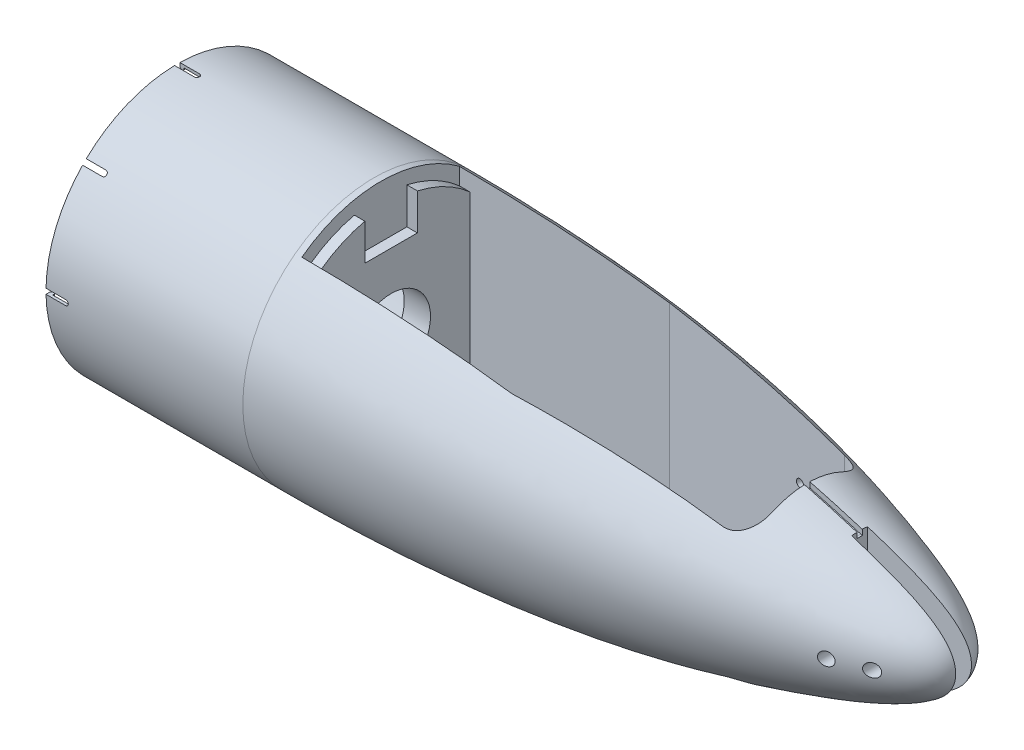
SolidWorks part; units mm, degrees
ref_plane "Plan de face" through (0, 0, 0) normal (0, 0, 1) x (1, 0, 0)
ref_plane "Plan de dessus" through (0, 0, 0) normal (0, 1, 0) x (1, 0, 0)
ref_plane "Plan de droite" through (0, 0, 0) normal (1, 0, 0) x (0, 0, -1)
sketch "Esquisse1" plane through (0, 0, 0) normal (0, 0, 1) x (1, 0, 0)
  line L0 (-8.8433, 0) -> (730.3993, 0) construction
  line L1 (0, 100) -> (150, 100)
  line L2 (600, 218.0578) -> (600, -141.2619) construction
  line L3 (600, -45.7609) -> (600, 53.6794) construction
  line L4 (137, 53.6357) -> (138, 53.6357)
  line L5 (143, 48.6357) -> (143, 0)
  line L7 (600, 0) -> (143, 0)
  line L8 (3, 96) -> (0, 96)
  line L9 (0, 100) -> (0, 96)
  line L10 (3, 97.9954) -> (3, 96)
  arc A0 (143, 48.6357) -> (138, 53.6357) centre (138, 48.6357) ccw
  spline S0 degree 3 poles (150, 100) (330.744, 100) (523.987, 58.056) (600, 22.2177) (600, 0) knots 0 0 0 0 0.598241 1 1 1 1
  spline S1 degree 3 poles (1208.675, -1647.8713) (160.0356, 15.2751) (156.5031, 22.0178) (142.0364, 46.0991) (141.7308, 46.6091) (141.3556, 47.2297) (140.8715, 48.0125) (139.9991, 49.3851) (138.7162, 51.2924) (136.5744, 54.2557) (133.7423, 57.7829) (128.905, 63.0587) (122.3364, 68.9747) (110.9199, 77.0765) (95.3093, 84.85) (75.377, 91.1248) (58.4349, 94.3621) (45.0715, 96.0519) (35.2422, 96.9383) (25.7058, 97.5116) (18.0872, 97.7834) (12.2417, 97.9099) (7.9944, 97.9674) (-48.1395, 98.353) (-62.4351, 92.9816) (2001.9041, 161.8289) knots -0.515918 -0.515918 -0.515918 -0.515918 0.007937 0.011905 0.015874 0.019842 0.02381 0.031747 0.047621 0.063495 0.095242 0.126989 0.190484 0.253978 0.380968 0.507957 0.634946 0.69844 0.761935 0.82543 0.888924 0.920671 0.952419 0.984166 2.22719 2.22719 2.22719 2.22719 only from (143, 44.4943) to (3, 97.9954) construction
  spline S2 degree 3 poles (137, 53.6357) (135.9392, 55.0467) (133.7056, 57.8229) (128.905, 63.0587) (122.3364, 68.9747) (110.9199, 77.0765) (95.3093, 84.85) (75.377, 91.1248) (58.4349, 94.3621) (45.0715, 96.0519) (35.2422, 96.9383) (25.7058, 97.5116) (18.0872, 97.7834) (12.2417, 97.9099) (7.9944, 97.9674) (4.9499, 97.9883) (3.3075, 97.9945) (3, 97.9954) knots 0.064458 0.064458 0.064458 0.064458 0.095242 0.126989 0.190484 0.253978 0.380968 0.507957 0.634946 0.69844 0.761935 0.82543 0.888924 0.920671 0.952419 0.984166 0.991532 0.991532 0.991532 0.991532
  point P18 (143, 53.6357)
  dimension "D6" = 5
  dimension "D1" = 450
  dimension "D2" = 6
  dimension "D3" = 600
  dimension "D4" = 80
  dimension "D5" = 52
  dimension "D7" = 457
  dimension "D8" = 4
revolve "Révolution1" add sketch "Esquisse1" angle 360 about L0
sketch "Esquisse2" plane through (0, 0, 0) normal (0, 0, 1) x (1, 0, 0)
  line L0 (600, 218.0578) -> (600, -141.2619) construction
  line L1 (520, 92.9537) -> (621.7344, 92.9537)
  line L2 (520, 92.9537) -> (520, -83.2647)
  line L3 (520, -83.2647) -> (621.7344, -83.2647)
  line L4 (621.7344, 92.9537) -> (621.7344, -83.2647)
  dimension "D1" = 80
extrude "Enlèv. mat.-Extru.1" cut sketch "Esquisse2" against normal mid plane 12
sketch "Esquisse3" plane through (0, 0, 0) normal (0, 1, 0) x (1, 0, 0)
  line L0 (-42.7948, 0) -> (651.3997, 0) construction
  line L1 (155, -60) -> (315, -60)
  line L2 (155, 60) -> (155, -60)
  line L3 (315, -60) -> (461.8107, -46.6536)
  line L4 (480, 26.7357) -> (480, -26.7357)
  line L5 (155, 60) -> (315, 60)
  line L6 (315, 60) -> (461.8107, 46.6536)
  arc A0 (461.8107, -46.6536) -> (480, -26.7357) centre (460, -26.7357) ccw
  arc A1 (461.8107, 46.6536) -> (480, 26.7357) centre (460, 26.7357) cw
  point P11 (480, -45)
  point P14 (480, 45)
  dimension "D9" = 20
  dimension "D1" = 120
  dimension "D2" = 60
  dimension "D3" = 90
  dimension "D4" = 45
  dimension "D5" = 325
  dimension "D6" = 155
  dimension "D7" = 160
  dimension "D8" = 160
extrude "Enlèv. mat.-Extru.2" cut sketch "Esquisse3" against normal mid plane 300
sketch "Esquisse4" plane through (143, 0, 0) normal (-1, 0, 0) x (0, 0, 1)
  circle A0 centre (0, 0) radius 30
  dimension "D1" = 60
extrude "Enlèv. mat.-Extru.3" cut sketch "Esquisse4" against normal blind 20
sketch "Esquisse7" plane through (0, 0, 0) normal (0, 1, 0) x (1, 0, 0)
  line L0 (540, 60.949) -> (540, -65.4895) construction
  line L1 (520, -6) -> (520, 6) construction
  line L2 (-21.3041, 0) -> (618.2976, 0) construction
  line L4 (540, -27.5821) -> (540, 25.0504)
  line L6 (537, -15) -> (537, 15)
  line L7 (540, 50.5643) -> (535, 50.5643)
  line L8 (540, 50.5643) -> (540, 25.0504)
  line L9 (537, 15) -> (535, 15)
  line L10 (535, 50.5643) -> (535, 15)
  line L11 (540, -50.2076) -> (535, -50.2076)
  line L12 (540, -50.2076) -> (540, -27.5821)
  line L13 (537, -15) -> (535, -15)
  line L14 (535, -50.2076) -> (535, -15)
  dimension "D1" = 20
  dimension "D2" = 3
  dimension "D3" = 5
  dimension "D4" = 15
  dimension "D5" = 30
revolve "Enlèvement de matière-Révolution1" cut sketch "Esquisse7" angle 360 about L0
pattern_linear "Répétition linéaire1" count 2 spacing 25 along (1, 0, 0) of "Enlèvement de matière-Révolution1"
sketch "Esquisse9" plane through (155, 0, 0) normal (1, 0, 0) x (0, 0, -1)
  line L0 (-60, -79.992) -> (-60, 79.992) construction
  line L1 (-60, -67.0734) -> (-60, 67.0734)
  line L2 (60, -79.992) -> (60, 79.992) construction
  line L3 (60, -67.0734) -> (60, 67.0734)
  line L6 (-20, 87.7431) -> (-20, 60)
  line L7 (-20, 60) -> (20, 60)
  line L8 (20, 87.7431) -> (20, 60)
  arc A9 (53.9996, 71.9923) -> (-53.9996, 71.9923) centre (0, 0) ccw
  arc A10 (60, 67.0734) -> (20, 87.7431) centre (0, 0) ccw
  circle A11 centre (0, 0) radius 30 construction
  arc A12 (-53.9996, -71.9923) -> (53.9996, -71.9923) centre (0, 0) ccw
  arc A13 (-60, -67.0734) -> (60, -67.0734) centre (0, 0) ccw
  circle A14 centre (0, 0) radius 30
  arc A15 (-20, 87.7431) -> (-60, 67.0734) centre (0, 0) ccw
  dimension "D3" = 40
  dimension "D4" = 20
  dimension "D5" = 60
  dimension "D1" = 10
  dimension "D2" = 10
extrude "Boss.-Extru.1" add sketch "Esquisse9" along normal blind 8
chamfer "Chanfrein1" distance 0.6 angle 45 1 edges at (3, 0, 96)
chamfer "Chanfrein2" distance 1 angle 45 1 edges at (0, 0, 96)
sketch "Esquisse10" plane through (0, 0, 0) normal (0, 1, 0) x (1, 0, 0)
  line L0 (-18.6309, 0) -> (61.7232, 0) construction
  line L1 (-10.2022, 0) -> (15, 0) construction
  line L2 (-10.2022, 2) -> (15, 2)
  line L3 (-10.2022, -2) -> (15, -2)
  arc A0 (-10.2022, 2) -> (-10.2022, -2) centre (-10.2022, 0) ccw
  arc A1 (15, -2) -> (15, 2) centre (15, 0) ccw
  point P5 (2.3989, 0)
  dimension "D2" = 2
extrude "Enlèv. mat.-Extru.6" cut sketch "Esquisse10" along normal through all
pattern_circular "Répétition circulaire1" count 8 over 360 about axis through (0, 0, 0) along (1, 0, 0) of "Enlèv. mat.-Extru.6"
ref_plane "Plan1" through (0, 76.6044, 64.2788) normal (0, 0.766, 0.6428) x (1, 0, 0)
sketch "Esquisse11" plane through (0, 76.6044, 64.2788) normal (0, 0.766, 0.6428) x (1, 0, 0)
  circle A0 centre (158.7675, -4.4412) radius 4
  dimension "D1" = 8
extrude "Enlèv. mat.-Extru.7" [suppressed] cut sketch "Esquisse11" against normal blind 10
sketch "Esquisse12" plane through (7.9918, 0, -87.9098) normal (-0.0905, 0, 0.9959) x (0.9959, 0, 0.0905)
  line L0 (308.2742, -69.9218) -> (308.2742, 69.9218) construction
  circle A0 centre (418.2742, 10.5035) radius 3
  circle A1 centre (418.2742, -29.4965) radius 3
  dimension "D1" = 6
  dimension "D2" = 110
  dimension "D3" = 40
extrude "Enlèv. mat.-Extru.8" cut sketch "Esquisse12" against normal blind 15
sketch "Esquisse13" plane through (0, 0, 0) normal (0, 0, 1) x (1, 0, 0)
  line L0 (520, 52) -> (520, 47.811)
  line L2 (480, 63.3983) -> (480, 59.265)
  line L5 (518.812, 48.1805) -> (520, 47.811)
  line L6 (520, 51.6527) -> (520, -51.6527) construction
  arc A0 (155, 99.9936) -> (150, 100) centre (150.0041, -1843.1888) ccw
  arc A1 (150, -100) -> (155, -99.9936) centre (150.0041, 1843.1888) ccw
  spline S0 degree 3 poles (-1479.0499, -261.6206) (1829.8918, 905.8923) (9.1735, -1444.3028) (972.879, 1999.9089) knots -15.481619 -15.481619 -15.481619 -15.481619 26.863834 26.863834 26.863834 26.863834 only from (480, 63.3983) to (520, 52)
  spline S1 degree 3 poles (972.8984, -1999.9783) (9.1493, 1444.3335) (1829.9132, -905.899) (-1479.0475, 261.6198) knots -25.864119 -25.864119 -25.864119 -25.864119 16.481609 16.481609 16.481609 16.481609 only from (520, -52) to (480, -63.3983)
  spline S2 degree 1 poles (478.9946, 59.5267) (518.812, 48.1805) knots 0 0 1 1 construction
  spline S3 degree 3 poles (480, 63.3983) (494.5457, 59.6211) (507.8443, 55.7808) (520, 52) knots 0 0 0 0 1 1 1 1
  spline S4 degree 3 poles (478.9946, 59.5267) (480.7869, 59.0613) (484.3944, 58.1125) (491.3904, 56.2259) (499.8742, 53.8538) (507.9702, 51.4858) (514.2468, 49.5912) (517.2831, 48.656) (518.812, 48.1805) knots 0 0 0 0 0.125 0.25 0.5 0.75 0.875 1 1 1 1 only from (480, 59.265) to (518.812, 48.1805)
  dimension "D1" = 4
extrude "Enlèv. mat.-Extru.9" cut sketch "Esquisse13" against normal mid plane 4
sketch "Esquisse14" plane through (7.9918, 0, 87.9098) normal (-0.0905, 0, -0.9959) x (-0.9959, 0, 0.0905)
  line L0 (-308.2742, -69.9218) -> (-308.2742, 69.9218) construction
  circle A0 centre (-418.2742, 20.3414) radius 3
  circle A1 centre (-418.2742, -19.6586) radius 3
  dimension "D2" = 6
  dimension "D1" = 40
  dimension "D3" = 110
extrude "Enlèv. mat.-Extru.10" cut sketch "Esquisse14" against normal blind 20
sketch "Esquisse15" plane through (0, 0, 0) normal (1, 0, 0) x (0, 0, -1)
  line L0 (0, 114.2691) -> (121.1601, 114.2691)
  line L1 (0, 0) -> (-105.6145, 0)
  line L2 (0, 0) -> (0, 114.2691)
  line L3 (0, 114.2691) -> (-105.6145, 114.2691)
  line L4 (-105.6145, 0) -> (-105.6145, 114.2691)
  line L5 (121.1601, 114.2691) -> (121.1601, 0)
  line L6 (121.1601, 0) -> (0, 0)
  line L7 (0, 0) -> (0, -116.429)
  line L8 (0, -116.429) -> (121.1601, -116.429)
  line L9 (121.1601, -116.429) -> (121.1601, 0)
extrude "Enlèv. mat.-Extru.11" [suppressed] cut sketch "Esquisse15" along normal through all contours L6 L5 L0 L2 | L8 L9 L6 L7
